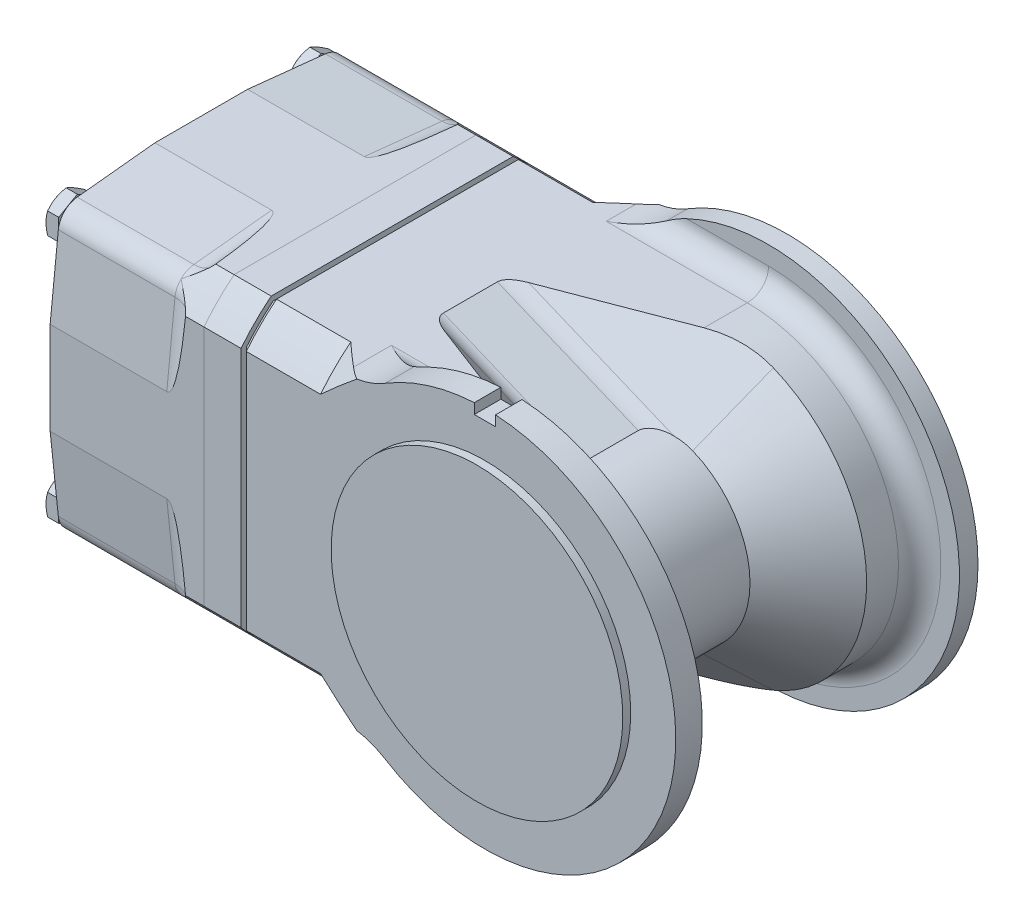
SolidWorks part; units mm, degrees
other "<CR82446713>-<Cut-Extrude1>"
other "<CR82446713>-<Cut-Extrude1>"
other "<CR82446713>-<Cut-Extrude1>"
other "<CR82446713>-<Cut-Extrude1>"
other "<Copy of Copy of Krau41204D64i45k_2^CR82451109>-<Imported1>"
ref_plane "Front" through (0, 0, 0) normal (0, 0, 1) x (1, 0, 0)
ref_plane "Top" through (0, 0, 0) normal (0, 1, 0) x (1, 0, 0)
ref_plane "Right" through (0, 0, 0) normal (1, 0, 0) x (0, 0, -1)
imported_body "Imported1"
ref_plane "Front-Copy of Copy of Krau41204D64i45k_2^CR82451109" through (153.4651, -179.0552, -474.7601) normal (0, 0, 1) x (1, 0, 0)
ref_plane "Top-Copy of Copy of Krau41204D64i45k_2^CR82451109" through (153.4651, -179.0552, -474.7601) normal (0, 1, 0) x (1, 0, 0)
ref_plane "Right-Copy of Copy of Krau41204D64i45k_2^CR82451109" through (153.4651, -179.0552, -474.7601) normal (1, 0, 0) x (0, 0, -1)
inserted part "Copy of Copy of Krau41204D64i45k_2^CR82451109"
move or copy body "Corpo-Sposta/copia1" bodies to move or copy 102 placed by mates yes
move or copy body "Corpo-Sposta/copia2" bodies to move or copy 103 placed by mates yes
ref_plane "Plane1 (Front/Back)-CR82446713" through (-63.117, -9.8027, -89.2381) normal (0, 0, 1) x (1, 0, 0)
ref_plane "Plane2 (Top/Bottom)-CR82446713" through (-63.117, -9.8027, -89.2381) normal (0, 1, 0) x (1, 0, 0)
ref_plane "Plane3 (Left/Right)-CR82446713" through (-63.117, -9.8027, -89.2381) normal (1, 0, 0) x (0, 0, -1)
inserted part "CR82446713"
ref_plane "Plane1 (Front/Back)-CR824467132" through (-90.8951, -15.2095, -70.4538) normal (0, 0, 1) x (1, 0, 0)
ref_plane "Plane2 (Top/Bottom)-CR824467132" through (-90.8951, -15.2095, -70.4538) normal (0, 1, 0) x (1, 0, 0)
ref_plane "Plane3 (Left/Right)-CR824467132" through (-90.8951, -15.2095, -70.4538) normal (1, 0, 0) x (0, 0, -1)
inserted part "CR824467132"
ref_plane "Plane1 (Front/Back)-CR824467133" through (-120.2658, -21.2664, -79.083) normal (0, 0, 1) x (1, 0, 0)
ref_plane "Plane2 (Top/Bottom)-CR824467133" through (-120.2658, -21.2664, -79.083) normal (0, 1, 0) x (1, 0, 0)
ref_plane "Plane3 (Left/Right)-CR824467133" through (-120.2658, -21.2664, -79.083) normal (1, 0, 0) x (0, 0, -1)
inserted part "CR824467133"
ref_plane "Plane1 (Front/Back)-CR824467134" through (-110.5741, -27.6038, -68.426) normal (0, 0, 1) x (1, 0, 0)
ref_plane "Plane2 (Top/Bottom)-CR824467134" through (-110.5741, -27.6038, -68.426) normal (0, 1, 0) x (1, 0, 0)
ref_plane "Plane3 (Left/Right)-CR824467134" through (-110.5741, -27.6038, -68.426) normal (1, 0, 0) x (0, 0, -1)
inserted part "CR824467134"
move or copy body "Corpo-Sposta/copia3" bodies to move or copy 105 placed by mates yes
move or copy body "Corpo-Sposta/copia4" bodies to move or copy 109 placed by mates yes
move or copy body "Corpo-Sposta/copia5" bodies to move or copy 106 placed by mates yes
move or copy body "Corpo-Sposta/copia6" bodies to move or copy 111 placed by mates yes
move or copy body "Corpo-Sposta/copia7" bodies to move or copy 108 placed by mates yes
move or copy body "Corpo-Sposta/copia8" bodies to move or copy 113 placed by mates yes
move or copy body "Corpo-Sposta/copia9" bodies to move or copy 107 placed by mates yes
move or copy body "Corpo-Sposta/copia10" bodies to move or copy 115 placed by mates yes
